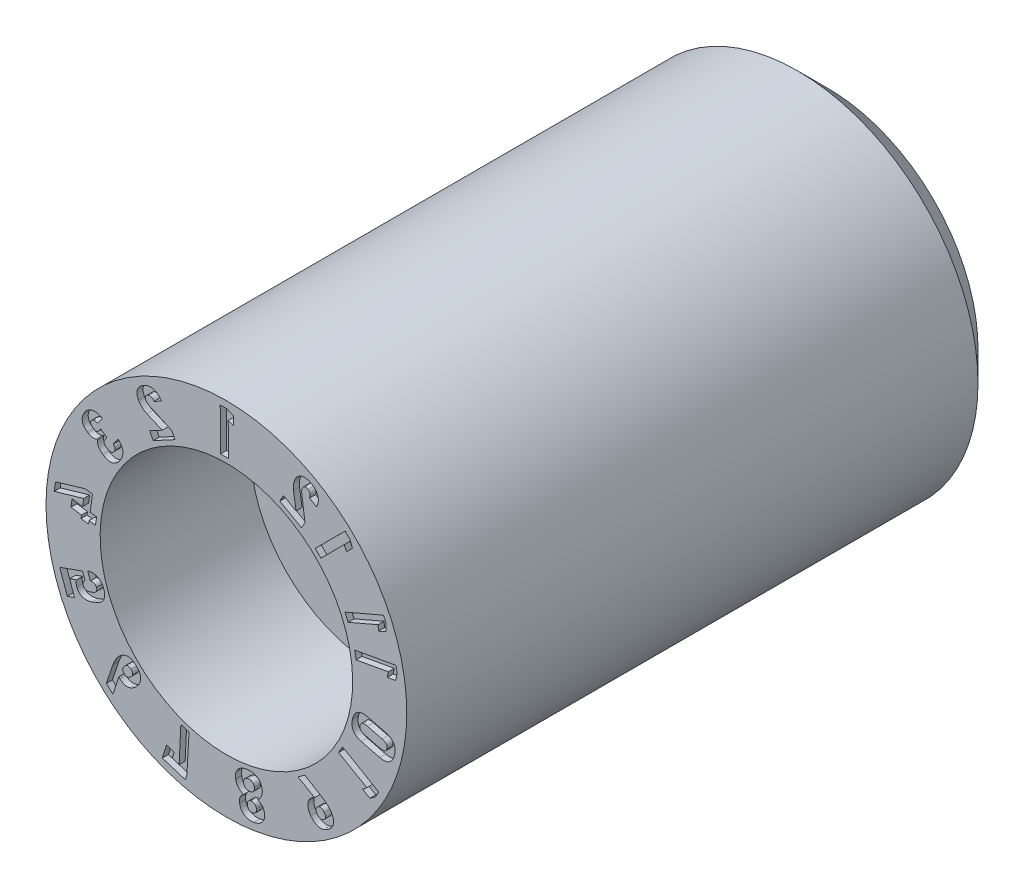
SolidWorks part; units mm, degrees
ref_plane "Front Plane" through (0, 0, 0) normal (0, 0, 1) x (1, 0, 0)
ref_plane "Top Plane" through (0, 0, 0) normal (0, 1, 0) x (1, 0, 0)
ref_plane "Right Plane" through (0, 0, 0) normal (1, 0, 0) x (0, 0, -1)
sketch "Sketch1" plane through (0, 0, 0) normal (1, 0, 0) x (0, 0, -1)
  line L0 (0, 0) -> (25.4137, 0) construction
  line L2 (10, 0.8) -> (10, 2.5)
  line L4 (9.5, 3) -> (0, 3)
  line L5 (0, 3) -> (0, 2.1)
  line L7 (0, 2.1) -> (2.5, 2.1)
  line L8 (2.5, 2.1) -> (2.5, 0.8)
  line L9 (2.5, 0.8) -> (10, 0.8)
  line L12 (10, 2.5) -> (9.5, 3)
  point P6 (10, 3)
  dimension "D1" = 10
  dimension "D2" = 6
  dimension "D3" = 4.2
  dimension "D4" = 2.5
  dimension "D5" = 1.6
revolve "Revolve1" add sketch "Sketch1" angle 360 about L0
sketch "Sketch2" plane through (0, 0, 0) normal (0, 0, 1) x (1, 0, 0)
  line L0 (-0.0987, 2.1834) -> (0.0335, 2.1841)
  line L1 (0.0335, 2.1841) -> (0.0306, 2.7307)
  line L2 (0.0306, 2.7307) -> (0.1164, 2.6987)
  line L3 (0.1164, 2.6987) -> (0.1157, 2.8393)
  line L4 (0.1157, 2.8393) -> (0.0106, 2.8859)
  line L5 (0.0106, 2.8859) -> (-0.1023, 2.8853)
  line L6 (-0.1023, 2.8853) -> (-0.0987, 2.1834)
  line L7 (-0.9091, 2.1158) -> (-1.27, 2.2798)
  line L8 (-1.3405, 2.3386) -> (-1.3409, 2.3394)
  line L9 (-1.1999, 2.3893) -> (-1.1997, 2.3888)
  line L10 (-1.1997, 2.3888) -> (-1.0807, 2.4529)
  line L11 (-1.0807, 2.4529) -> (-1.0809, 2.4533)
  line L12 (-1.4621, 2.2785) -> (-1.4619, 2.278)
  line L13 (-1.3214, 2.15) -> (-1.0667, 2.0403)
  line L14 (-1.0667, 2.0403) -> (-1.2772, 1.9269)
  line L15 (-1.2772, 1.9269) -> (-1.2169, 1.8151)
  line L16 (-1.2169, 1.8151) -> (-0.8528, 2.0112)
  line L17 (-0.8528, 2.0112) -> (-0.9091, 2.1158)
  line L18 (-1.8019, 1.545) -> (-1.88, 1.4339)
  line L19 (-1.977, 1.3167) -> (-1.9904, 1.3261)
  line L20 (-2.0216, 1.4261) -> (-1.9876, 1.4743)
  line L21 (-1.9876, 1.4743) -> (-2.0913, 1.5472)
  line L22 (-2.0913, 1.5472) -> (-2.1253, 1.499)
  line L23 (-2.2144, 1.4976) -> (-2.2242, 1.5044)
  line L24 (-2.1416, 1.6044) -> (-2.0638, 1.7151)
  line L25 (-2.3162, 1.3967) -> (-2.299, 1.3846)
  line L26 (-2.0634, 1.2048) -> (-2.046, 1.1927)
  line L27 (-2.3464, 0.5569) -> (-2.843, 0.4089)
  line L28 (-2.843, 0.4089) -> (-2.8638, 0.2611)
  line L29 (-2.8638, 0.2611) -> (-2.3738, 0.404)
  line L30 (-2.3738, 0.404) -> (-2.3916, 0.2776)
  line L31 (-2.4176, 0.0926) -> (-2.2918, 0.0749)
  line L32 (-2.2918, 0.0749) -> (-2.2842, 0.1292)
  line L33 (-2.2263, 0.5399) -> (-2.3464, 0.5569)
  line L34 (-2.5671, 0.3024) -> (-2.5856, 0.1718)
  line L35 (-2.5856, 0.1718) -> (-2.41, 0.147)
  line L36 (-2.1774, 0.1142) -> (-2.1589, 0.2448)
  line L37 (-2.1589, 0.2448) -> (-2.2657, 0.2599)
  line L38 (-2.3072, -0.6044) -> (-2.3077, -0.6045)
  line L39 (-2.3077, -0.6045) -> (-2.2632, -0.7292)
  line L40 (-2.2632, -0.7292) -> (-2.2627, -0.729)
  line L41 (-2.218, -0.8704) -> (-2.2735, -0.8901)
  line L42 (-2.3505, -0.7675) -> (-2.392, -0.6512)
  line L43 (-2.392, -0.6512) -> (-2.7721, -0.7868)
  line L44 (-2.7721, -0.7868) -> (-2.6453, -1.1419)
  line L45 (-2.6453, -1.1419) -> (-2.5252, -1.099)
  line L46 (-2.5252, -1.099) -> (-2.6075, -0.8686)
  line L47 (-2.6075, -0.8686) -> (-2.4908, -0.8269)
  line L48 (-2.229, -1.0148) -> (-2.1735, -0.995)
  line L49 (-1.7904, -1.5806) -> (-1.7907, -1.5809)
  line L50 (-1.8896, -1.7544) -> (-1.9951, -2.07)
  line L51 (-1.9951, -2.07) -> (-1.8872, -2.1731)
  line L52 (-1.8872, -2.1731) -> (-1.7893, -1.871)
  line L54 (-1.4966, -1.8653) -> (-1.4963, -1.8652)
  line L55 (-1.5858, -1.768) -> (-1.5862, -1.7684)
  line L56 (-1.6911, -1.6673) -> (-1.6909, -1.667)
  line L57 (-0.6569, -2.7176) -> (-0.6211, -2.0858)
  line L58 (-0.6211, -2.0858) -> (-0.7576, -2.0425)
  line L59 (-0.7576, -2.0425) -> (-0.7859, -2.6352)
  line L60 (-0.7859, -2.6352) -> (-0.9006, -2.5987)
  line L61 (-0.9006, -2.5987) -> (-0.8687, -2.4981)
  line L62 (-0.8687, -2.4981) -> (-0.9946, -2.4582)
  line L63 (-0.9946, -2.4582) -> (-1.0651, -2.6802)
  line L64 (-1.0651, -2.6802) -> (-0.6834, -2.8013)
  line L65 (-0.6834, -2.8013) -> (-0.6569, -2.7176)
  line L66 (0.154, -2.3657) -> (0.1558, -2.3772)
  line L67 (0.2187, -2.6783) -> (0.2215, -2.6964)
  line L68 (0.6326, -2.6306) -> (0.6298, -2.6125)
  line L69 (0.5955, -2.3068) -> (0.5937, -2.2954)
  line L70 (0.4661, -2.3352) -> (0.4671, -2.3419)
  line L71 (0.2886, -2.37) -> (0.2875, -2.3629)
  line L72 (0.4983, -2.628) -> (0.4993, -2.6348)
  line L73 (0.3495, -2.6582) -> (0.3483, -2.651)
  line L75 (1.402, -2.2767) -> (1.4023, -2.2771)
  line L76 (1.7311, -2.0356) -> (1.7309, -2.0352)
  line L77 (1.58, -1.9107) -> (1.3037, -1.7421)
  line L78 (1.3037, -1.7421) -> (1.1913, -1.8237)
  line L79 (1.1913, -1.8237) -> (1.4667, -1.9853)
  line L80 (1.6282, -2.1174) -> (1.6285, -2.1178)
  line L81 (1.5106, -2.2027) -> (1.5102, -2.2023)
  line L82 (1.9319, -1.0216) -> (1.8661, -1.1352)
  line L83 (1.8661, -1.1352) -> (2.3356, -1.4072)
  line L84 (2.3356, -1.4072) -> (2.265, -1.4646)
  line L85 (2.265, -1.4646) -> (2.3858, -1.5345)
  line L86 (2.3858, -1.5345) -> (2.4786, -1.4681)
  line L87 (2.4786, -1.4681) -> (2.5348, -1.3711)
  line L88 (2.5348, -1.3711) -> (1.9319, -1.0216)
  line L89 (2.2403, -0.7867) -> (2.5498, -0.8652)
  line L90 (2.653, -0.4579) -> (2.3435, -0.3794)
  line L91 (2.3439, -0.516) -> (2.5878, -0.578)
  line L92 (2.5495, -0.7286) -> (2.3057, -0.6667)
  line L93 (2.1337, 0.4734) -> (2.1571, 0.3438)
  line L94 (2.1571, 0.3438) -> (2.6922, 0.4405)
  line L95 (2.6922, 0.4405) -> (2.6755, 0.3512)
  line L96 (2.6755, 0.3512) -> (2.8131, 0.376)
  line L97 (2.8131, 0.376) -> (2.8409, 0.4869)
  line L98 (2.8409, 0.4869) -> (2.8209, 0.5975)
  line L99 (2.8209, 0.5975) -> (2.1337, 0.4734)
  line L100 (1.9726, 0.9402) -> (2.0246, 0.8192)
  line L101 (2.0246, 0.8192) -> (2.5239, 1.0342)
  line L102 (2.5239, 1.0342) -> (2.5279, 0.9436)
  line L103 (2.5279, 0.9436) -> (2.6563, 0.9988)
  line L104 (2.6563, 0.9988) -> (2.6583, 1.1131)
  line L105 (2.6583, 1.1131) -> (2.6139, 1.2162)
  line L106 (2.6139, 1.2162) -> (1.9726, 0.9402)
  line L107 (1.4782, 1.61) -> (1.5723, 1.5162)
  line L108 (1.5723, 1.5162) -> (1.9593, 1.905)
  line L109 (1.9593, 1.905) -> (1.9973, 1.8216)
  line L110 (1.9973, 1.8216) -> (2.0967, 1.9214)
  line L111 (2.0967, 1.9214) -> (2.0556, 2.0294)
  line L112 (2.0556, 2.0294) -> (1.9752, 2.1093)
  line L113 (1.9752, 2.1093) -> (1.4782, 1.61)
  line L114 (1.3071, 1.8963) -> (1.2536, 2.2895)
  line L115 (1.2658, 2.3805) -> (1.2662, 2.3812)
  line L116 (1.3834, 2.2882) -> (1.3832, 2.2878)
  line L117 (1.3832, 2.2878) -> (1.5011, 2.2211)
  line L118 (1.5011, 2.2211) -> (1.5013, 2.2216)
  line L119 (1.1502, 2.4515) -> (1.1499, 2.4512)
  line L120 (1.1163, 2.2638) -> (1.1589, 1.9896)
  line L121 (1.1589, 1.9896) -> (0.9507, 2.1075)
  line L122 (0.9507, 2.1075) -> (0.888, 1.9968)
  line L123 (0.888, 1.9968) -> (1.2485, 1.7927)
  line L124 (1.2485, 1.7927) -> (1.3071, 1.8963)
  line L125 (-2.41, 0.147) -> (-2.4176, 0.0926)
  line L126 (-2.3916, 0.2776) -> (-2.5671, 0.3024)
  line L127 (-2.2657, 0.2599) -> (-2.2263, 0.5399)
  line L128 (-2.2842, 0.1292) -> (-2.1774, 0.1142)
  circle A0 centre (0, 0) radius 2.19 construction
  spline S0 degree 3 poles (-1.27, 2.2798) (-1.2852, 2.2868) (-1.3035, 2.2972) (-1.3214, 2.3137) (-1.3313, 2.3241) (-1.3372, 2.3327) (-1.3405, 2.3386) knots 0 0 0 0 0.540031 0.665532 0.783527 1 1 1 1
  spline S1 degree 3 poles (-1.3409, 2.3394) (-1.3452, 2.3469) (-1.3493, 2.3589) (-1.3491, 2.3754) (-1.3459, 2.3869) (-1.3401, 2.3978) (-1.3281, 2.412) (-1.3159, 2.4199) (-1.3071, 2.4247) knots 0 0 0 0 0.246786 0.35691 0.469448 0.586307 0.710254 1 1 1 1
  spline S2 degree 3 poles (-1.3071, 2.4247) (-1.2983, 2.4294) (-1.284, 2.4345) (-1.2643, 2.4345) (-1.25, 2.4313) (-1.2363, 2.4251) (-1.218, 2.4124) (-1.2067, 2.3991) (-1.1999, 2.3893) knots 0 0 0 0 0.240301 0.353786 0.468513 0.587497 0.712892 1 1 1 1
  spline S3 degree 3 poles (-1.0809, 2.4533) (-1.0919, 2.4707) (-1.1101, 2.4948) (-1.1389, 2.5215) (-1.1614, 2.5375) (-1.185, 2.5502) (-1.2095, 2.5594) (-1.2349, 2.5646) (-1.2608, 2.5665) (-1.2872, 2.5647) (-1.3234, 2.5569) (-1.3497, 2.5462) (-1.3665, 2.537) knots 0 0 0 0 0.185247 0.270908 0.353799 0.433963 0.511943 0.589015 0.666847 0.746166 0.827199 1 1 1 1
  spline S4 degree 3 poles (-1.3665, 2.537) (-1.3843, 2.5274) (-1.4093, 2.5113) (-1.4378, 2.4857) (-1.4549, 2.4657) (-1.4687, 2.4448) (-1.4788, 2.423) (-1.4855, 2.4002) (-1.4881, 2.3766) (-1.4874, 2.3525) (-1.4808, 2.3188) (-1.4707, 2.2943) (-1.4621, 2.2785) knots 0 0 0 0 0.194583 0.283015 0.366623 0.445927 0.521986 0.596945 0.671952 0.748458 0.827747 1 1 1 1
  spline S5 degree 3 poles (-1.4619, 2.278) (-1.4542, 2.2641) (-1.4412, 2.2439) (-1.42, 2.2196) (-1.4027, 2.2024) (-1.384, 2.1866) (-1.3574, 2.168) (-1.3362, 2.1564) (-1.3214, 2.15) knots 0 0 0 0 0.246636 0.37153 0.498651 0.625609 0.751024 1 1 1 1
  spline S6 degree 3 poles (-1.7706, 1.2497) (-1.7591, 1.2661) (-1.7441, 1.2917) (-1.7306, 1.328) (-1.724, 1.3547) (-1.7212, 1.3814) (-1.7215, 1.4078) (-1.726, 1.4335) (-1.7336, 1.4586) (-1.7452, 1.4827) (-1.7661, 1.5135) (-1.7866, 1.5333) (-1.8019, 1.545) knots 0 0 0 0 0.181473 0.266228 0.349031 0.429721 0.5081 0.58621 0.664895 0.744781 0.826358 1 1 1 1
  spline S7 degree 3 poles (-1.88, 1.4339) (-1.8749, 1.4293) (-1.8681, 1.4218) (-1.861, 1.4108) (-1.8569, 1.4026) (-1.8542, 1.3941) (-1.8525, 1.3856) (-1.8521, 1.377) (-1.8526, 1.3684) (-1.8545, 1.3598) (-1.8584, 1.3481) (-1.8634, 1.3401) (-1.8668, 1.3348) knots 0 0 0 0 0.185948 0.272003 0.355057 0.435081 0.512073 0.590042 0.667455 0.74622 0.82701 1 1 1 1
  spline S8 degree 3 poles (-1.8668, 1.3348) (-1.8732, 1.3255) (-1.8844, 1.3134) (-1.9028, 1.3029) (-1.9171, 1.299) (-1.9319, 1.2983) (-1.953, 1.3023) (-1.9677, 1.3103) (-1.977, 1.3167) knots 0 0 0 0 0.265502 0.382854 0.496664 0.611875 0.731229 1 1 1 1
  spline S9 degree 3 poles (-1.9904, 1.3261) (-1.9998, 1.3331) (-2.0135, 1.3437) (-2.0257, 1.3617) (-2.0316, 1.3745) (-2.0343, 1.3877) (-2.0329, 1.4059) (-2.0272, 1.4186) (-2.0216, 1.4261) knots 0 0 0 0 0.300615 0.42856 0.545417 0.656048 0.764757 1 1 1 1
  spline S10 degree 3 poles (-2.1253, 1.499) (-2.1295, 1.4926) (-2.1379, 1.4849) (-2.1519, 1.4791) (-2.1633, 1.4779) (-2.1754, 1.4788) (-2.1933, 1.4845) (-2.2062, 1.4915) (-2.2144, 1.4976) knots 0 0 0 0 0.226653 0.333129 0.444988 0.564971 0.694922 1 1 1 1
  spline S11 degree 3 poles (-2.2242, 1.5044) (-2.2319, 1.51) (-2.2427, 1.519) (-2.2523, 1.534) (-2.2565, 1.5451) (-2.2579, 1.5566) (-2.2565, 1.5725) (-2.2505, 1.5835) (-2.2459, 1.5902) knots 0 0 0 0 0.287811 0.411477 0.527914 0.639876 0.752931 1 1 1 1
  spline S12 degree 3 poles (-2.2459, 1.5902) (-2.2426, 1.5949) (-2.2368, 1.6014) (-2.2274, 1.6078) (-2.2198, 1.6117) (-2.2116, 1.6147) (-2.2029, 1.6164) (-2.1936, 1.6171) (-2.1839, 1.6168) (-2.1737, 1.6153) (-2.1593, 1.6119) (-2.1487, 1.6076) (-2.1416, 1.6044) knots 0 0 0 0 0.150181 0.223297 0.297156 0.371585 0.449302 0.529052 0.614285 0.702509 0.795753 1 1 1 1
  spline S13 degree 3 poles (-2.0638, 1.7151) (-2.0812, 1.7252) (-2.1084, 1.7376) (-2.146, 1.7474) (-2.1733, 1.7508) (-2.2001, 1.7509) (-2.2261, 1.7475) (-2.2509, 1.7405) (-2.2747, 1.7304) (-2.297, 1.717) (-2.3252, 1.6953) (-2.3428, 1.6746) (-2.3532, 1.6599) knots 0 0 0 0 0.185488 0.271925 0.356057 0.43765 0.517094 0.59543 0.674143 0.753752 0.833671 1 1 1 1
  spline S14 degree 3 poles (-2.3532, 1.6599) (-2.3618, 1.648) (-2.3727, 1.6296) (-2.3845, 1.6044) (-2.3911, 1.5862) (-2.3956, 1.5681) (-2.3981, 1.5503) (-2.3987, 1.5326) (-2.3971, 1.5153) (-2.3939, 1.4984) (-2.3884, 1.4821) (-2.3813, 1.4663) (-2.3722, 1.451) (-2.361, 1.4364) (-2.343, 1.4175) (-2.3276, 1.4045) (-2.3162, 1.3967) knots 0 0 0 0 0.145025 0.211773 0.27583 0.33709 0.396198 0.454481 0.511605 0.568407 0.62506 0.681891 0.740574 0.801023 0.863801 1 1 1 1
  spline S15 degree 3 poles (-2.299, 1.3846) (-2.2864, 1.376) (-2.2665, 1.3648) (-2.2374, 1.3577) (-2.2158, 1.3554) (-2.1941, 1.3568) (-2.165, 1.3635) (-2.1446, 1.3736) (-2.1317, 1.382) knots 0 0 0 0 0.256766 0.378903 0.500094 0.620744 0.742279 1 1 1 1
  spline S16 degree 3 poles (-2.1317, 1.382) (-2.135, 1.3743) (-2.1385, 1.3625) (-2.1413, 1.3464) (-2.1421, 1.3346) (-2.1416, 1.3227) (-2.1402, 1.3109) (-2.1373, 1.2993) (-2.1322, 1.2836) (-2.1227, 1.2645) (-2.101, 1.2348) (-2.0794, 1.216) (-2.0634, 1.2048) knots 0 0 0 0 0.120942 0.178738 0.235933 0.293132 0.35041 0.408041 0.467423 0.589012 0.716166 1 1 1 1
  spline S17 degree 3 poles (-2.046, 1.1927) (-2.0303, 1.182) (-2.0063, 1.1677) (-1.972, 1.1564) (-1.9472, 1.1518) (-1.9226, 1.151) (-1.8986, 1.1542) (-1.875, 1.1608) (-1.8523, 1.1716) (-1.8301, 1.1858) (-1.801, 1.2104) (-1.7823, 1.2333) (-1.7706, 1.2497) knots 0 0 0 0 0.178299 0.259715 0.338099 0.414262 0.489196 0.564778 0.643204 0.724723 0.810858 1 1 1 1
  spline S18 degree 3 poles (-2.0403, -0.7275) (-2.0462, -0.7104) (-2.0582, -0.6864) (-2.0794, -0.6581) (-2.0975, -0.6397) (-2.1178, -0.624) (-2.1403, -0.6117) (-2.1645, -0.602) (-2.1907, -0.5957) (-2.2183, -0.5926) (-2.2577, -0.5932) (-2.2875, -0.5988) (-2.3072, -0.6044) knots 0 0 0 0 0.165351 0.244288 0.323078 0.400982 0.47883 0.557644 0.639484 0.72423 0.811685 1 1 1 1
  spline S19 degree 3 poles (-2.2627, -0.729) (-2.2514, -0.7261) (-2.2343, -0.7236) (-2.2125, -0.7262) (-2.1982, -0.7305) (-2.1856, -0.7375) (-2.171, -0.7502) (-2.164, -0.7634) (-2.1606, -0.7725) knots 0 0 0 0 0.28598 0.412917 0.532389 0.648289 0.760986 1 1 1 1
  spline S20 degree 3 poles (-2.1606, -0.7725) (-2.1572, -0.7823) (-2.1538, -0.7978) (-2.1576, -0.8178) (-2.1635, -0.8313) (-2.1728, -0.8434) (-2.1899, -0.8586) (-2.2064, -0.8661) (-2.218, -0.8704) knots 0 0 0 0 0.245538 0.357255 0.469313 0.585745 0.711147 1 1 1 1
  spline S21 degree 3 poles (-2.2735, -0.8901) (-2.2851, -0.8943) (-2.3023, -0.8988) (-2.3248, -0.899) (-2.3392, -0.896) (-2.3519, -0.8905) (-2.3664, -0.879) (-2.3736, -0.8668) (-2.3766, -0.8579) knots 0 0 0 0 0.302844 0.431574 0.550434 0.661796 0.769579 1 1 1 1
  spline S22 degree 3 poles (-2.3766, -0.8579) (-2.3796, -0.8496) (-2.3825, -0.8366) (-2.3821, -0.8194) (-2.3797, -0.8073) (-2.3752, -0.7958) (-2.3666, -0.7814) (-2.3573, -0.7726) (-2.3505, -0.7675) knots 0 0 0 0 0.263342 0.385863 0.507648 0.627192 0.748066 1 1 1 1
  spline S23 degree 3 poles (-2.4908, -0.8269) (-2.4939, -0.8335) (-2.4967, -0.8446) (-2.4986, -0.8603) (-2.4989, -0.8861) (-2.4949, -0.9078) (-2.4893, -0.9243) knots 0 0 0 0 0.221259 0.342937 0.474198 1 1 1 1
  spline S24 degree 3 poles (-2.4893, -0.9243) (-2.4835, -0.9404) (-2.4724, -0.963) (-2.452, -0.9886) (-2.4346, -1.0041) (-2.4152, -1.0169) (-2.3936, -1.0263) (-2.3701, -1.0323) (-2.3448, -1.0354) (-2.3178, -1.0349) (-2.2784, -1.0306) (-2.2489, -1.0217) (-2.229, -1.0148) knots 0 0 0 0 0.163657 0.239511 0.313509 0.387354 0.461741 0.538607 0.619723 0.705858 0.797119 1 1 1 1
  spline S25 degree 3 poles (-2.1735, -0.995) (-2.1536, -0.9879) (-2.1253, -0.9751) (-2.0924, -0.9523) (-2.0719, -0.9336) (-2.0549, -0.9131) (-2.0415, -0.8908) (-2.0318, -0.8668) (-2.0258, -0.8413) (-2.0237, -0.8144) (-2.0259, -0.7758) (-2.0336, -0.7468) (-2.0403, -0.7275) knots 0 0 0 0 0.18694 0.272046 0.353269 0.43122 0.506711 0.581925 0.65865 0.737396 0.819504 1 1 1 1
  spline S26 degree 3 poles (-1.4966, -1.5692) (-1.5111, -1.5553) (-1.5342, -1.5369) (-1.5681, -1.5192) (-1.5932, -1.5101) (-1.6186, -1.5053) (-1.644, -1.5042) (-1.6694, -1.5071) (-1.6947, -1.514) (-1.7196, -1.5251) (-1.7534, -1.5452) (-1.7759, -1.5658) (-1.7904, -1.5806) knots 0 0 0 0 0.180177 0.262991 0.342265 0.419093 0.494073 0.569807 0.647689 0.728634 0.813436 1 1 1 1
  spline S27 degree 3 poles (-1.7907, -1.5809) (-1.7998, -1.5903) (-1.8126, -1.6056) (-1.8283, -1.6275) (-1.8518, -1.6644) (-1.8679, -1.6977) (-1.8789, -1.7254) knots 0 0 0 0 0.230123 0.350639 0.475699 1 1 1 1
  spline S28 degree 3 poles (-1.8789, -1.7254) (-1.8808, -1.7302) (-1.8849, -1.7397) (-1.8879, -1.7496) (-1.8896, -1.7544) knots 0 0 0 0 0.50536 1 1 1 1
  spline S29 degree 3 poles (-1.7893, -1.871) (-1.7844, -1.878) (-1.7787, -1.8843) (-1.7726, -1.8902) knots 0.759919 0.759919 0.759919 0.759919 1 1 1 1
  spline S30 degree 3 poles (-1.7726, -1.8902) (-1.7596, -1.9026) (-1.7387, -1.9191) (-1.7077, -1.934) (-1.6846, -1.9413) (-1.661, -1.9446) (-1.6372, -1.9445) (-1.6133, -1.9402) (-1.5893, -1.9325) (-1.5655, -1.9209) (-1.5328, -1.9004) (-1.5108, -1.8801) (-1.4966, -1.8653) knots 0 0 0 0 0.171911 0.25061 0.326761 0.401984 0.476839 0.553147 0.632554 0.716253 0.804371 1 1 1 1
  spline S31 degree 3 poles (-1.4963, -1.8652) (-1.4816, -1.8501) (-1.4625, -1.826) (-1.4433, -1.7912) (-1.4334, -1.7655) (-1.4272, -1.7398) (-1.4254, -1.714) (-1.4273, -1.6885) (-1.4335, -1.6633) (-1.4434, -1.6386) (-1.4627, -1.6055) (-1.4821, -1.5831) (-1.4966, -1.5692) knots 0 0 0 0 0.187278 0.272507 0.353965 0.431955 0.507955 0.583051 0.659476 0.73806 0.820178 1 1 1 1
  spline S32 degree 3 poles (-1.5845, -1.661) (-1.5769, -1.6682) (-1.567, -1.6803) (-1.5604, -1.6992) (-1.559, -1.7132) (-1.5609, -1.7274) (-1.5681, -1.747) (-1.578, -1.76) (-1.5858, -1.768) knots 0 0 0 0 0.25988 0.375973 0.488654 0.604089 0.724464 1 1 1 1
  spline S33 degree 3 poles (-1.5862, -1.7684) (-1.5951, -1.7776) (-1.6091, -1.7902) (-1.6305, -1.8002) (-1.6456, -1.8041) (-1.6606, -1.8042) (-1.6806, -1.7995) (-1.6936, -1.7903) (-1.7012, -1.783) knots 0 0 0 0 0.294468 0.419976 0.537202 0.647939 0.758507 1 1 1 1
  spline S34 degree 3 poles (-1.7012, -1.783) (-1.7088, -1.7759) (-1.7184, -1.7632) (-1.7237, -1.7434) (-1.724, -1.7284) (-1.7209, -1.713) (-1.7114, -1.6913) (-1.7001, -1.6765) (-1.6911, -1.6673) knots 0 0 0 0 0.24016 0.350245 0.463156 0.580574 0.706813 1 1 1 1
  spline S35 degree 3 poles (-1.6909, -1.667) (-1.6832, -1.659) (-1.6706, -1.6486) (-1.6514, -1.6403) (-1.6374, -1.638) (-1.6234, -1.6387) (-1.6045, -1.6448) (-1.5919, -1.6537) (-1.5845, -1.661) knots 0 0 0 0 0.277062 0.397428 0.512563 0.62626 0.741394 1 1 1 1
  spline S36 degree 3 poles (0.343, -2.1378) (0.3223, -2.1413) (0.2921, -2.1483) (0.2555, -2.165) (0.2311, -2.1795) (0.2097, -2.1965) (0.1912, -2.2154) (0.1762, -2.2367) (0.1644, -2.2598) (0.156, -2.2845) (0.15, -2.32) (0.1509, -2.3475) (0.154, -2.3657) knots 0 0 0 0 0.188977 0.27682 0.361569 0.443246 0.522148 0.599298 0.677101 0.755105 0.83325 1 1 1 1
  spline S37 degree 3 poles (0.1558, -2.3772) (0.1585, -2.3942) (0.1664, -2.4191) (0.1834, -2.4496) (0.1997, -2.4706) (0.2183, -2.4897) (0.2466, -2.5109) (0.2706, -2.5222) (0.2874, -2.5272) knots 0 0 0 0 0.24595 0.369875 0.497302 0.624923 0.749887 1 1 1 1
  spline S38 degree 3 poles (0.2874, -2.5272) (0.2752, -2.5358) (0.2584, -2.5509) (0.2409, -2.5752) (0.2303, -2.5948) (0.2225, -2.6153) (0.2162, -2.6431) (0.2164, -2.6645) (0.2187, -2.6783) knots 0 0 0 0 0.256726 0.383635 0.511859 0.637851 0.759402 1 1 1 1
  spline S39 degree 3 poles (0.2215, -2.6964) (0.2243, -2.7136) (0.2313, -2.7386) (0.2472, -2.7685) (0.2619, -2.7883) (0.2791, -2.8056) (0.2989, -2.82) (0.3206, -2.832) (0.3447, -2.8408) (0.3706, -2.847) (0.4081, -2.8505) (0.4369, -2.849) (0.4562, -2.8456) knots 0 0 0 0 0.166884 0.246053 0.324356 0.402056 0.479239 0.557959 0.639716 0.724649 0.812019 1 1 1 1
  spline S40 degree 3 poles (0.4562, -2.8456) (0.4755, -2.8423) (0.5037, -2.8356) (0.5379, -2.82) (0.5606, -2.8063) (0.5806, -2.7903) (0.5979, -2.7722) (0.6119, -2.7522) (0.623, -2.7304) (0.6306, -2.7071) (0.6367, -2.6737) (0.6353, -2.6478) (0.6326, -2.6306) knots 0 0 0 0 0.188035 0.275676 0.359981 0.441818 0.520591 0.598495 0.675899 0.754169 0.832942 1 1 1 1
  spline S41 degree 3 poles (0.6298, -2.6125) (0.6278, -2.5984) (0.6209, -2.5779) (0.6062, -2.5531) (0.592, -2.5362) (0.5756, -2.5211) (0.5513, -2.5036) (0.5303, -2.495) (0.5159, -2.4907) knots 0 0 0 0 0.242626 0.3641 0.490539 0.617681 0.743637 1 1 1 1
  spline S42 degree 3 poles (0.5159, -2.4907) (0.5306, -2.4807) (0.5498, -2.4621) (0.5705, -2.4331) (0.5825, -2.4092) (0.5916, -2.3842) (0.5988, -2.35) (0.5983, -2.3238) (0.5955, -2.3068) knots 0 0 0 0 0.252226 0.376998 0.504745 0.631563 0.754935 1 1 1 1
  spline S43 degree 3 poles (0.5937, -2.2954) (0.591, -2.277) (0.5833, -2.2506) (0.5664, -2.2188) (0.5508, -2.198) (0.5323, -2.1798) (0.5116, -2.164) (0.4879, -2.1519) (0.4623, -2.1424) (0.4346, -2.1363) (0.3946, -2.1321) (0.3637, -2.1345) (0.343, -2.1378) knots 0 0 0 0 0.166554 0.245226 0.322916 0.400249 0.47767 0.556369 0.63832 0.723174 0.810916 1 1 1 1
  spline S44 degree 3 poles (0.3632, -2.2637) (0.3715, -2.2623) (0.384, -2.2617) (0.4002, -2.2637) (0.4114, -2.2668) (0.4219, -2.2713) (0.4317, -2.2767) (0.4402, -2.2839) (0.4478, -2.2921) (0.4544, -2.3015) (0.4617, -2.3155) (0.4648, -2.3272) (0.4661, -2.3352) knots 0 0 0 0 0.180053 0.264369 0.347011 0.427481 0.50643 0.584318 0.66459 0.745066 0.82721 1 1 1 1
  spline S45 degree 3 poles (0.4671, -2.3419) (0.4681, -2.3493) (0.4688, -2.3605) (0.4662, -2.3749) (0.4627, -2.3849) (0.4578, -2.3942) (0.4518, -2.4029) (0.4443, -2.4106) (0.4356, -2.4175) (0.4257, -2.4234) (0.411, -2.4302) (0.3988, -2.4331) (0.3904, -2.4345) knots 0 0 0 0 0.166389 0.245774 0.324127 0.401036 0.478754 0.557638 0.639825 0.724353 0.811459 1 1 1 1
  spline S46 degree 3 poles (0.3904, -2.4345) (0.382, -2.4357) (0.3695, -2.4368) (0.3533, -2.4351) (0.3422, -2.4325) (0.3318, -2.4287) (0.3224, -2.4234) (0.3138, -2.4172) (0.3062, -2.4097) (0.2997, -2.4011) (0.2929, -2.3882) (0.2897, -2.3775) (0.2886, -2.37) knots 0 0 0 0 0.188474 0.275198 0.360269 0.441191 0.520185 0.597926 0.676115 0.755046 0.834173 1 1 1 1
  spline S47 degree 3 poles (0.2875, -2.3629) (0.2862, -2.3549) (0.2857, -2.3429) (0.288, -2.3273) (0.2914, -2.3165) (0.296, -2.3063) (0.3021, -2.2971) (0.3096, -2.2888) (0.3183, -2.2815) (0.328, -2.2751) (0.3429, -2.2683) (0.3548, -2.2649) (0.3632, -2.2637) knots 0 0 0 0 0.173778 0.254718 0.335683 0.414821 0.493743 0.571177 0.652365 0.735479 0.820481 1 1 1 1
  spline S48 degree 3 poles (0.4108, -2.5613) (0.4178, -2.56) (0.4285, -2.5596) (0.4422, -2.5617) (0.4517, -2.5646) (0.4606, -2.5687) (0.4688, -2.574) (0.4762, -2.5804) (0.4826, -2.5882) (0.4882, -2.5969) (0.4942, -2.61) (0.4973, -2.6206) (0.4983, -2.628) knots 0 0 0 0 0.173838 0.255177 0.335334 0.414326 0.491269 0.570236 0.650821 0.73402 0.818688 1 1 1 1
  spline S49 degree 3 poles (0.4993, -2.6348) (0.5003, -2.6416) (0.5011, -2.652) (0.499, -2.6653) (0.4964, -2.6745) (0.4926, -2.6833) (0.4874, -2.6911) (0.4813, -2.6983) (0.474, -2.7045) (0.4658, -2.71) (0.4534, -2.7159) (0.4431, -2.7184) (0.436, -2.7197) knots 0 0 0 0 0.175248 0.257091 0.338037 0.416807 0.495075 0.573435 0.65385 0.735675 0.820091 1 1 1 1
  spline S50 degree 3 poles (0.436, -2.7197) (0.429, -2.7207) (0.4184, -2.7217) (0.4048, -2.7196) (0.3952, -2.7173) (0.3864, -2.7135) (0.3783, -2.7086) (0.371, -2.7026) (0.3647, -2.6955) (0.3591, -2.6874) (0.3533, -2.6751) (0.3505, -2.6651) (0.3495, -2.6582) knots 0 0 0 0 0.179112 0.262747 0.344694 0.424028 0.50258 0.580234 0.659693 0.741501 0.824387 1 1 1 1
  spline S51 degree 3 poles (0.3483, -2.651) (0.347, -2.6438) (0.3466, -2.633) (0.3481, -2.6189) (0.3509, -2.6091) (0.3546, -2.5999) (0.3595, -2.5914) (0.3658, -2.584) (0.3729, -2.5772) (0.3811, -2.5716) (0.3934, -2.5652) (0.4037, -2.5624) (0.4108, -2.5613) knots 0 0 0 0 0.178209 0.262814 0.344874 0.425545 0.504461 0.582683 0.662101 0.743229 0.825445 1 1 1 1
  spline S52 degree 3 poles (1.4667, -1.9853) (1.466, -1.9856) (1.4609, -1.9873) (1.4463, -1.9933) (1.4337, -2.0016) (1.4252, -2.0075) knots 0.563272 0.563272 0.563272 0.563272 0.582457 0.712545 1 1 1 1
  spline S53 degree 3 poles (1.4252, -2.0075) (1.4118, -2.0174) (1.3933, -2.0341) (1.3749, -2.061) (1.3644, -2.0823) (1.3575, -2.1049) (1.3535, -2.1284) (1.3534, -2.1526) (1.3564, -2.1775) (1.3629, -2.2026) (1.376, -2.237) (1.3909, -2.2611) (1.402, -2.2767) knots 0 0 0 0 0.164687 0.243 0.320771 0.398263 0.475705 0.554876 0.637235 0.722309 0.810467 1 1 1 1
  spline S54 degree 3 poles (1.4023, -2.2771) (1.4148, -2.2939) (1.4346, -2.3176) (1.4656, -2.3424) (1.4889, -2.357) (1.5131, -2.3674) (1.5378, -2.3741) (1.5632, -2.3767) (1.589, -2.3752) (1.6151, -2.3698) (1.6511, -2.3568) (1.6766, -2.3418) (1.6928, -2.3299) knots 0 0 0 0 0.187675 0.273076 0.354399 0.432079 0.507842 0.582608 0.659159 0.737961 0.820071 1 1 1 1
  spline S55 degree 3 poles (1.6928, -2.3299) (1.7091, -2.3183) (1.7312, -2.2988) (1.7545, -2.2686) (1.7676, -2.2453) (1.7767, -2.221) (1.7821, -2.1959) (1.7832, -2.17) (1.7807, -2.1435) (1.7742, -2.1165) (1.7594, -2.0792) (1.7438, -2.0525) (1.7311, -2.0356) knots 0 0 0 0 0.17805 0.259654 0.33813 0.414765 0.490064 0.565894 0.644319 0.726149 0.811832 1 1 1 1
  spline S56 degree 3 poles (1.7309, -2.0352) (1.7238, -2.0253) (1.7116, -2.0112) (1.6935, -1.9933) (1.6782, -1.9798) (1.6616, -1.9663) (1.637, -1.9479) (1.6176, -1.9345) (1.6041, -1.9258) knots 0 0 0 0 0.216627 0.332173 0.453194 0.580305 0.713714 1 1 1 1
  spline S57 degree 3 poles (1.6041, -1.9258) (1.6001, -1.9231) (1.5921, -1.9181) (1.5843, -1.9128) (1.58, -1.9107) knots 0 0 0 0 0.504712 1 1 1 1
  spline S58 degree 3 poles (1.5194, -2.0908) (1.5278, -2.0847) (1.5416, -2.0774) (1.5617, -2.0752) (1.5762, -2.0771) (1.5904, -2.0822) (1.6093, -2.0945) (1.6212, -2.1075) (1.6282, -2.1174) knots 0 0 0 0 0.246693 0.358778 0.471984 0.588823 0.71275 1 1 1 1
  spline S59 degree 3 poles (1.6285, -2.1178) (1.6353, -2.1274) (1.6441, -2.1421) (1.649, -2.1633) (1.6494, -2.178) (1.6464, -2.1921) (1.6374, -2.2099) (1.6265, -2.2208) (1.618, -2.2268) knots 0 0 0 0 0.28325 0.406265 0.522769 0.635825 0.748302 1 1 1 1
  spline S60 degree 3 poles (1.618, -2.2268) (1.6095, -2.2328) (1.5957, -2.2403) (1.5757, -2.2429) (1.5614, -2.2415) (1.5475, -2.2366) (1.5289, -2.225) (1.5174, -2.2123) (1.5106, -2.2027) knots 0 0 0 0 0.252145 0.365992 0.478155 0.594598 0.717793 1 1 1 1
  spline S61 degree 3 poles (1.5102, -2.2023) (1.5031, -2.1925) (1.4943, -2.1772) (1.4887, -2.1555) (1.4882, -2.1405) (1.4909, -2.1262) (1.4997, -2.108) (1.5109, -2.0969) (1.5194, -2.0908) knots 0 0 0 0 0.28754 0.410631 0.526441 0.638437 0.751688 1 1 1 1
  spline S62 degree 3 poles (2.0986, -0.534) (2.0947, -0.5497) (2.09, -0.5729) (2.0882, -0.6035) (2.0887, -0.6247) (2.0914, -0.6448) (2.0959, -0.6639) (2.1025, -0.6819) (2.111, -0.6987) (2.1215, -0.7143) (2.1336, -0.7287) (2.1471, -0.7419) (2.1626, -0.7535) (2.1797, -0.7638) (2.2052, -0.7763) (2.2259, -0.7831) (2.2403, -0.7867) knots 0 0 0 0 0.147108 0.214438 0.278381 0.339971 0.398767 0.456376 0.513598 0.57028 0.626979 0.683952 0.742119 0.80231 0.865074 1 1 1 1
  spline S63 degree 3 poles (2.5498, -0.8652) (2.5643, -0.8687) (2.5859, -0.8729) (2.6145, -0.8742) (2.6345, -0.8732) (2.6536, -0.8702) (2.6719, -0.8652) (2.6894, -0.8582) (2.7059, -0.8494) (2.7214, -0.8386) (2.7357, -0.8259) (2.7486, -0.8112) (2.7605, -0.7948) (2.7709, -0.7763) (2.7837, -0.7486) (2.791, -0.7262) (2.7948, -0.7105) knots 0 0 0 0 0.13594 0.198952 0.259288 0.317551 0.375017 0.431183 0.488003 0.54502 0.602438 0.66146 0.722464 0.786442 0.85357 1 1 1 1
  spline S64 degree 3 poles (2.7948, -0.7105) (2.7987, -0.6948) (2.8032, -0.6716) (2.8053, -0.641) (2.8049, -0.6198) (2.8023, -0.5997) (2.7979, -0.5806) (2.7916, -0.5626) (2.7831, -0.5458) (2.7728, -0.5303) (2.7608, -0.5159) (2.747, -0.5029) (2.7315, -0.4912) (2.7144, -0.4808) (2.6886, -0.4684) (2.6676, -0.4616) (2.653, -0.4579) knots 0 0 0 0 0.1469 0.213952 0.278179 0.339429 0.397853 0.455345 0.51213 0.56835 0.624568 0.681764 0.740276 0.800382 0.863507 1 1 1 1
  spline S65 degree 3 poles (2.3435, -0.3794) (2.329, -0.3759) (2.3074, -0.3717) (2.2789, -0.3704) (2.2589, -0.3714) (2.2398, -0.3744) (2.2215, -0.3794) (2.2041, -0.3863) (2.1876, -0.3952) (2.1721, -0.406) (2.1579, -0.4187) (2.1449, -0.4334) (2.133, -0.4498) (2.1225, -0.4681) (2.1097, -0.4959) (2.1026, -0.5184) (2.0986, -0.534) knots 0 0 0 0 0.136024 0.199076 0.25945 0.317748 0.374639 0.431449 0.487705 0.544759 0.602212 0.661271 0.722313 0.78634 0.85351 1 1 1 1
  spline S66 degree 3 poles (2.2221, -0.5654) (2.2236, -0.5593) (2.2266, -0.5506) (2.2322, -0.5401) (2.237, -0.5333) (2.2426, -0.5274) (2.2487, -0.5223) (2.2557, -0.5182) (2.2658, -0.5136) (2.2804, -0.5101) (2.3078, -0.5087) (2.3292, -0.5123) (2.3439, -0.516) knots 0 0 0 0 0.125633 0.182804 0.23847 0.291625 0.345061 0.398011 0.453087 0.568397 0.695558 1 1 1 1
  spline S67 degree 3 poles (2.5878, -0.578) (2.6024, -0.5818) (2.6232, -0.5884) (2.6464, -0.603) (2.6576, -0.6129) (2.6644, -0.6217) (2.6685, -0.6286) (2.6714, -0.6361) (2.6734, -0.6439) (2.6743, -0.6522) (2.6744, -0.6641) (2.6727, -0.6731) (2.6712, -0.6792) knots 0 0 0 0 0.304308 0.432419 0.547403 0.601642 0.655137 0.708632 0.761957 0.816738 0.874369 1 1 1 1
  spline S68 degree 3 poles (2.6712, -0.6792) (2.6697, -0.6853) (2.6668, -0.694) (2.6611, -0.7044) (2.6563, -0.7112) (2.6508, -0.7171) (2.6447, -0.7223) (2.6379, -0.7265) (2.6276, -0.7309) (2.6131, -0.7346) (2.5857, -0.7359) (2.5642, -0.7324) (2.5495, -0.7286) knots 0 0 0 0 0.125698 0.182899 0.238594 0.291777 0.344002 0.397805 0.452154 0.568172 0.6954 1 1 1 1
  spline S69 degree 3 poles (2.3057, -0.6667) (2.291, -0.6629) (2.2702, -0.6562) (2.247, -0.6417) (2.236, -0.6316) (2.2291, -0.6228) (2.2251, -0.6159) (2.222, -0.6085) (2.2201, -0.6007) (2.219, -0.5925) (2.219, -0.5805) (2.2207, -0.5715) (2.2221, -0.5654) knots 0 0 0 0 0.305203 0.43234 0.547537 0.601766 0.655252 0.708131 0.761446 0.816771 0.874391 1 1 1 1
  spline S70 degree 3 poles (1.2536, 2.2895) (1.2514, 2.3061) (1.2503, 2.3271) (1.2549, 2.3511) (1.2584, 2.365) (1.2627, 2.3745) (1.2658, 2.3805) knots 0 0 0 0 0.540854 0.665328 0.783096 1 1 1 1
  spline S71 degree 3 poles (1.2662, 2.3812) (1.2705, 2.3886) (1.2783, 2.3988) (1.2924, 2.4074) (1.3039, 2.4108) (1.3163, 2.4115) (1.3347, 2.4091) (1.348, 2.4028) (1.3567, 2.3981) knots 0 0 0 0 0.246977 0.357639 0.470298 0.587002 0.712461 1 1 1 1
  spline S72 degree 3 poles (1.3567, 2.3981) (1.3655, 2.3932) (1.3774, 2.3839) (1.3879, 2.3671) (1.3928, 2.3533) (1.3948, 2.3383) (1.3937, 2.3159) (1.3882, 2.2992) (1.3834, 2.2882) knots 0 0 0 0 0.240595 0.353002 0.467657 0.587204 0.712514 1 1 1 1
  spline S73 degree 3 poles (1.5013, 2.2216) (1.5102, 2.2401) (1.5211, 2.2685) (1.5283, 2.3072) (1.5299, 2.3349) (1.5281, 2.3617) (1.5226, 2.3873) (1.5138, 2.4116) (1.5013, 2.4345) (1.4856, 2.4558) (1.4602, 2.4827) (1.4366, 2.4986) (1.4201, 2.5082) knots 0 0 0 0 0.185812 0.271428 0.354384 0.434677 0.512593 0.589401 0.667461 0.746639 0.827415 1 1 1 1
  spline S74 degree 3 poles (1.4201, 2.5082) (1.4024, 2.518) (1.3757, 2.5312) (1.3387, 2.5412) (1.3128, 2.5454) (1.2877, 2.5459) (1.2638, 2.5425) (1.2409, 2.5361) (1.2195, 2.5258) (1.1994, 2.5123) (1.1745, 2.4886) (1.1588, 2.4673) (1.1502, 2.4515) knots 0 0 0 0 0.194492 0.282755 0.366202 0.44557 0.521879 0.596779 0.671827 0.748451 0.827594 1 1 1 1
  spline S75 degree 3 poles (1.1499, 2.4512) (1.1419, 2.4373) (1.1323, 2.4153) (1.1226, 2.3846) (1.1174, 2.3606) (1.1141, 2.3363) (1.1121, 2.3039) (1.114, 2.2797) (1.1163, 2.2638) knots 0 0 0 0 0.246329 0.371481 0.498035 0.625315 0.750897 1 1 1 1
  dimension "D1" = 4.38
extrude "Cut-Extrude1" cut sketch "Sketch2" against normal blind 0.1
